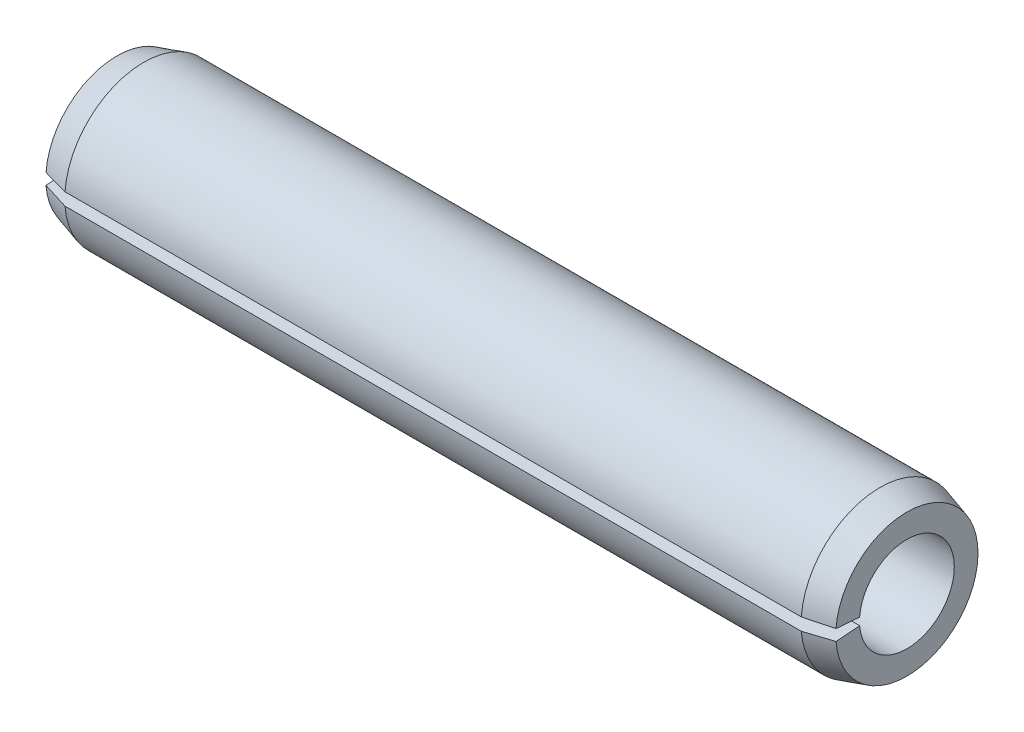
SolidWorks part; units mm, degrees
ref_plane "Plane1" through (0, 0, 0) normal (0, 0, 1) x (1, 0, 0)
ref_plane "Plane2" through (0, 0, 0) normal (0, 1, 0) x (1, 0, 0)
ref_plane "Plane3" through (0, 0, 0) normal (1, 0, 0) x (0, 0, -1)
sketch "Sketch1" plane through (0, 0, 0) normal (0, 0, 1) x (1, 0, 0)
  line L0 (-9.525, 0) -> (111.125, 0) construction
  line L1 (0, 6) -> (100, 6)
  line L2 (100, 6) -> (100, 9)
  line L3 (100, 9) -> (96.6, 10)
  line L4 (96.6, 10) -> (3.4, 10)
  line L5 (3.4, 10) -> (0, 9)
  line L7 (0, 9) -> (0, 6)
  dimension "D1" = 18
  dimension "D2" = 18
  dimension "Diameter" = 20
  dimension "D3" = 3.4
  dimension "Length" = 100
  dimension "Thickness" = 4
  dimension "Chamfer_len" = 3.4
revolve "Base-Revolve" add sketch "Sketch1" angle 360 about L0
sketch "Sketch2" plane through (0, 0, 0) normal (-1, 0, 0) x (0, -1, 0)
  line L0 (0, 0) -> (0.8003, 10.1686)
  line L1 (0, -3.175) -> (0, 12.7) construction
  line L2 (0, 0) -> (-0.8003, 10.1686)
  arc A0 (0.8003, 10.1686) -> (-0.8003, 10.1686) centre (0, 0) ccw
  dimension "D1" = 10.2
  dimension "Gap_ang" = 9
extrude "Gap" cut sketch "Sketch2" against normal through all
equation "\"D1@Sketch2\" = \"Diameter@Sketch1\" * 0.51"
equation "\"D1@Sketch1\" = \"Diameter@Sketch1\" -  ( \"Thickness@Sketch1\" / 2 ) "
equation "\"D2@Sketch1\" = \"D1@Sketch1\""
equation "\"D3@Sketch1\" = \"Chamfer_len@Sketch1\""
